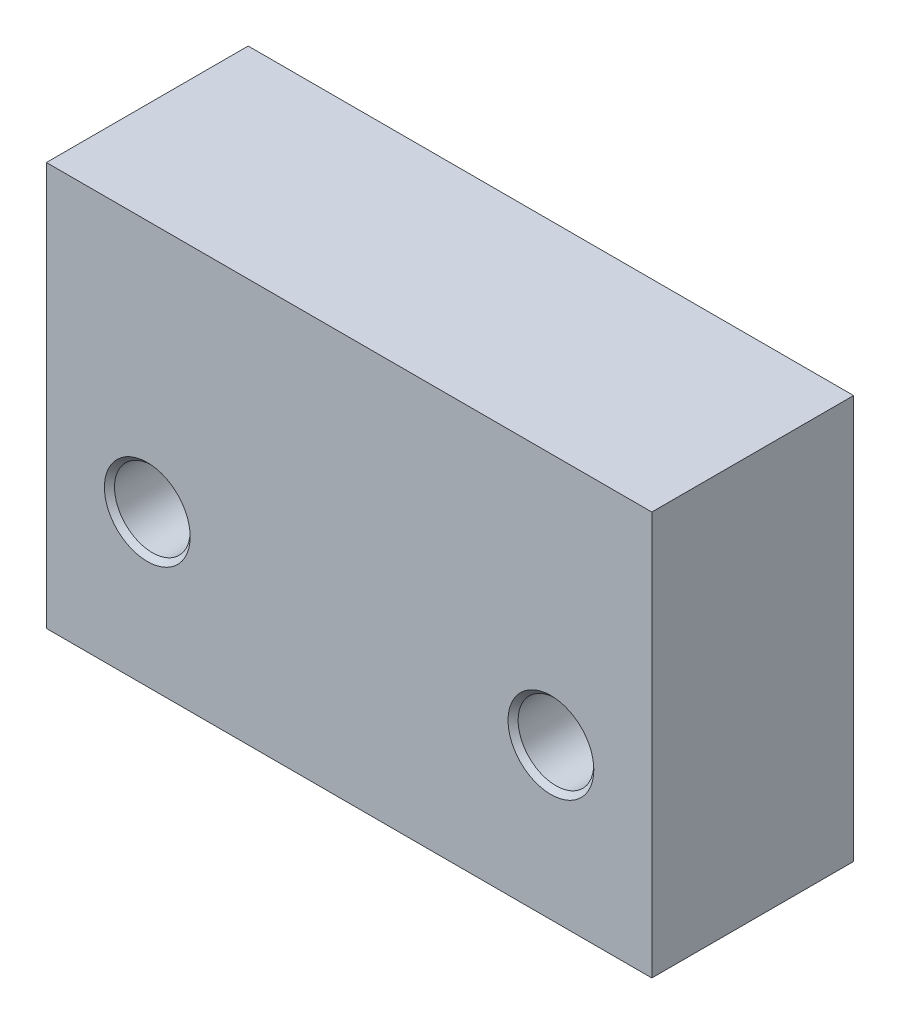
SolidWorks part; units mm, degrees
ref_plane "Front Plane" through (0, 0, 0) normal (0, 0, 1) x (1, 0, 0)
ref_plane "Top Plane" through (0, 0, 0) normal (0, 1, 0) x (1, 0, 0)
ref_plane "Right Plane" through (0, 0, 0) normal (1, 0, 0) x (0, 0, -1)
sketch "Sketch2" plane through (0, 0, 0) normal (0, 0, 1) x (1, 0, 0)
  line L1 (-39.49, 71.8733) -> (36.7208, 71.8733)
  line L2 (-39.49, 71.8733) -> (-39.49, 21.0733)
  line L3 (-39.49, 21.0733) -> (36.7208, 21.0733)
  line L4 (36.7208, 71.8733) -> (36.7208, 21.0733)
extrude "Boss-Extrude1" add sketch "Sketch2" along normal blind 25.4 contours L2 L1 L4 L3
hole_wizard "3/8 (0.375) Diameter Hole1" positions "Sketch3" profile "Sketch4" hole size "3/8" standard "ANSI Inch"
sketch "Sketch3" plane through (0, 0, 25.4) normal (0, 0, 1) x (1, 0, 0)
  line L0 (-39.49, 71.8733) -> (-39.49, 21.0733) construction
  line L1 (-39.49, 71.8733) -> (36.7208, 71.8733) construction
  line L2 (36.7208, 71.8733) -> (36.7208, 21.0733) construction
  point P0 (24.0208, 40.1233)
  point P2 (-26.79, 40.1233)
  dimension "D1" = 12.7
  dimension "D2" = 31.75
  dimension "D3" = 31.75
  dimension "D4" = 12.7
sketch "Sketch4" plane through (24.0208, 40.1233, 25.4) normal (1, 0, 0) x (0, -1, 0)
  line L0 (0, 0) -> (0, 25.4)
  line L1 (0, 25.4) -> (4.7625, 25.4)
  line L2 (4.7625, 25.4) -> (4.7625, 0.635)
  line L3 (4.7625, 0.635) -> (5.3975, 0)
  line L5 (5.3975, 0) -> (0, 0)
  line L6 (-4.7625, 0.635) -> (-5.3975, 0) construction
  line L11 (0, -6.35) -> (0, 107.95) construction
  dimension "Thru Hole Dia." = 9.525
  dimension "Thru Hole Depth" = 25.4
  dimension "Near C'Sink Dia." = 10.795
  dimension "Near C'Sink Angle" = 90
hole_wizard "35/64 (0.54688) Diameter Hole1" positions "Sketch5" profile "Sketch6" hole size "35/64" standard "ANSI Inch"
sketch "Sketch5" plane through (0, 21.0733, 0) normal (0, -1, 0) x (-1, 0, 0)
  line L0 (39.49, -25.4) -> (39.49, 0) construction
  line L1 (39.49, 0) -> (-36.7208, 0) construction
  point P0 (1.39, -12.7)
  dimension "D1" = 12.7
  dimension "D2" = 38.1
sketch "Sketch6" plane through (-1.39, 21.0733, 12.7) normal (1, 0, 0) x (0, 0, -1)
  line L0 (0, 0) -> (0, 29.5732)
  line L1 (0, 29.5732) -> (6.9454, 25.4)
  line L2 (6.9454, 25.4) -> (6.9454, 0.635)
  line L3 (6.9454, 0.635) -> (7.5804, 0)
  line L5 (7.5804, 0) -> (0, 0)
  line L6 (-6.9454, 0.635) -> (-7.5804, 0) construction
  line L10 (0, 29.5732) -> (-6.9454, 25.4) construction
  line L11 (0, -6.35) -> (0, 107.95) construction
  dimension "Hole Dia." = 13.8908
  dimension "Hole Depth" = 25.4
  dimension "Near C'Sink Dia." = 15.1608
  dimension "Near C'Sink Angle" = 90
  dimension "Drill Angle" = 118
